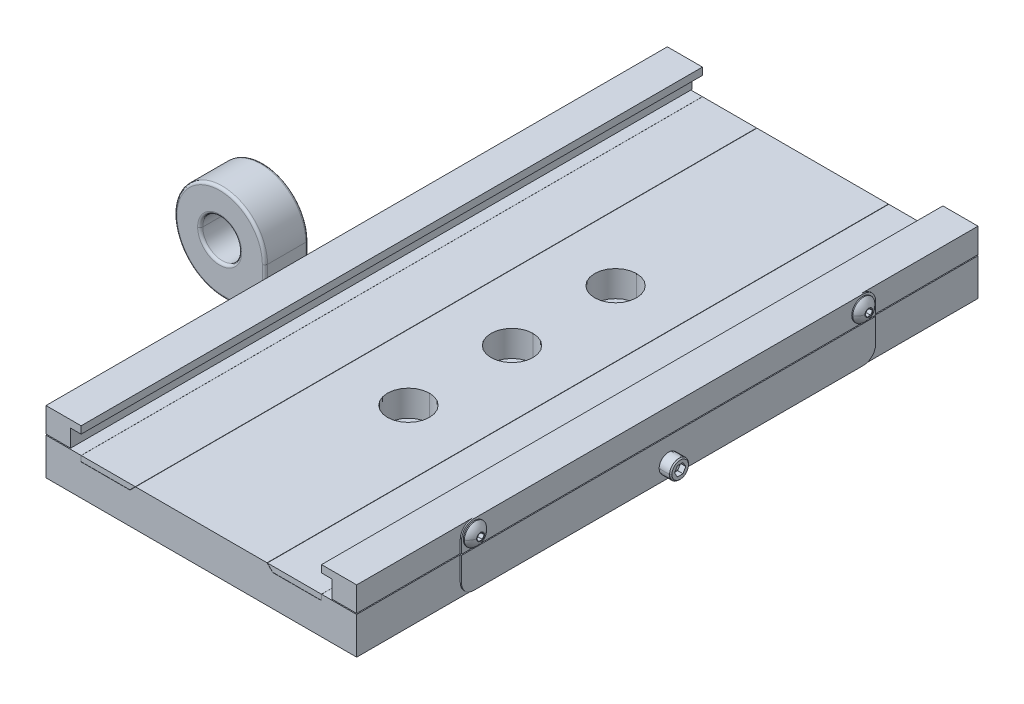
SolidWorks part; units mm, degrees
ref_plane "Plan de face" through (0, 0, 0) normal (0, 0, 1) x (1, 0, 0)
ref_plane "Plan de dessus" through (0, 0, 0) normal (0, 1, 0) x (1, 0, 0)
ref_plane "Plan de droite" through (0, 0, 0) normal (1, 0, 0) x (0, 0, -1)
imported_body "Newport-443 fix.STEP"
sketch "Esquisse1" plane through (0, 0, 152.4) normal (0, 0, 1) x (1, 0, 0)
  line L1 (-38.1, 9.579) -> (-38.11, 9.579)
  line L2 (-38.1, 9.579) -> (-38.1, -3.6371)
  line L3 (-38.1, -3.6371) -> (-38.11, -3.6371)
  line L4 (-38.11, 9.579) -> (-38.11, -3.6371)
  dimension "D1" = 0.01
extrude "Enlèv. mat.-Extru.1" cut sketch "Esquisse1" against normal through all
ref_plane "Plan1" through (0, 0, 0) normal (-1, 0, 0) x (0, 0, 1)
